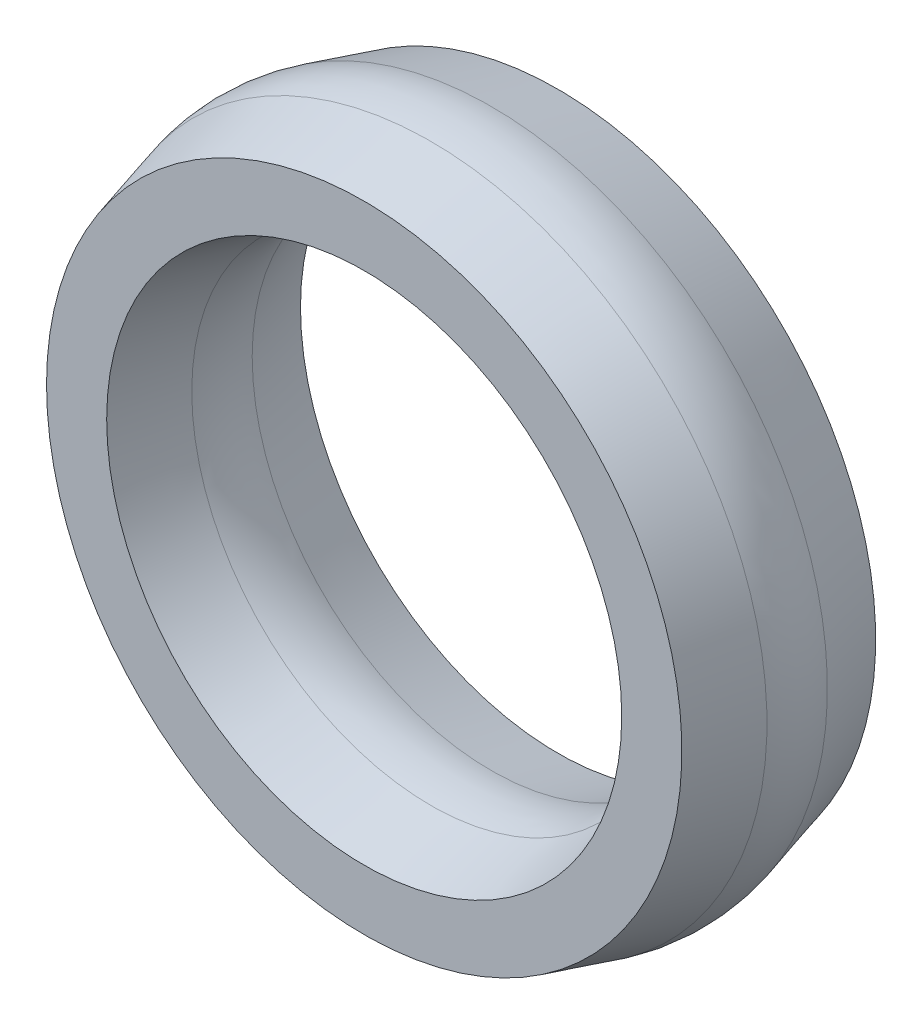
SolidWorks part; units mm, degrees
ref_plane "Front" through (0, 0, 0) normal (0, 0, 1) x (1, 0, 0)
ref_plane "Top" through (0, 0, 0) normal (0, 1, 0) x (1, 0, 0)
ref_plane "Right" through (0, 0, 0) normal (1, 0, 0) x (0, 0, -1)
other "Configuration Table"
sketch "Sketch1" plane through (0, 0, 0) normal (0, 1, 0) x (-1, 0, 0)
  line L0 (0, -7.25) -> (0, 7.5642) construction
  line L1 (0, -7.25) -> (-28.4986, -7.25) construction
  line L2 (-23.7675, 0) -> (-19.2675, 0)
  line L3 (-19.2675, 0) -> (-17.8911, -4.9896)
  line L4 (-21.5175, 0) -> (-21.5175, -7.25) construction
  line L5 (-19.2675, -14.5) -> (-17.8911, -9.5104)
  line L6 (-23.7675, -14.5) -> (-19.2675, -14.5)
  line L7 (-23.7675, -14.5) -> (-25.1439, -9.5104)
  line L8 (-23.7675, 0) -> (-25.1439, -4.9896)
  arc A0 (-17.8911, -9.5104) -> (-17.8911, -4.9896) centre (-26.085, -7.25) ccw
  arc A1 (-25.1439, -9.5104) -> (-25.1439, -4.9896) centre (-16.95, -7.25) cw
  point P12 (-17.2675, -7.25)
  point P17 (-21.5175, -14.5)
revolve "Body" add sketch "Sketch1" angle 360 about L0
sketch "Sketch4" plane through (0, 0, 0) normal (0, 1, 0) x (-1, 0, 0)
  line L0 (-19.2675, 0) -> (-19.2675, -14.5)
  line L1 (-19.2675, 0) -> (-25.45, 0)
  line L2 (-25.45, 0) -> (-25.45, -14.5)
  line L3 (-25.45, -14.5) -> (-19.2675, -14.5)
  line L4 (0, 0) -> (0, 12.1247) construction
  arc A0 (-25.1439, -4.9896) -> (-25.1439, -9.5104) centre (-16.95, -7.25) ccw construction
revolve "Cut-Revolve1" [suppressed] cut sketch "Sketch4" angle 360 about L4
sketch "Sketch3" plane through (0, 0, 0) normal (0, 1, 0) x (1, 0, 0)
  line L0 (-16.95, 14.5) -> (-16.95, 0)
  line L1 (-16.95, 0) -> (-21.45, 0)
  line L2 (-21.45, 0) -> (-23.2, 4.35)
  line L3 (-23.2, 4.35) -> (-25.45, 5.8)
  line L4 (-25.45, 5.8) -> (-25.45, 8.7)
  line L5 (-25.45, 7.25) -> (-16.95, 7.25) construction
  line L6 (-23.2, 10.15) -> (-25.45, 8.7)
  line L7 (-21.45, 14.5) -> (-23.2, 10.15)
  line L8 (-16.95, 14.5) -> (-21.45, 14.5)
  line L10 (0, -15.5494) -> (0, 19.4432) construction
revolve "Revolve1" [suppressed] add sketch "Sketch3" angle 360 about L10
fillet "Fillet1" [suppressed] radius 2.9
fillet "Fillet2" [suppressed] radius 2.9
equation "\"D4@Sketch1\" = \"s@Sketch1\""
equation "\"D3@Sketch3\" = \"D1@Sketch3\" / 5"
equation "\"D5@Sketch3\" = \"s1@Sketch3\" / 2"
equation "\"D6@Sketch3\" = \"D3@Sketch3\" * 2"
equation "\"D1@Fillet2\" = \"D3@Sketch3\""
equation "\"D1@Fillet1\" = \"D3@Sketch3\""
equation "\"D7@Sketch3\" = \"D@Sketch1\""
equation "\"D1@Sketch3\" = \"h@Sketch1\""
